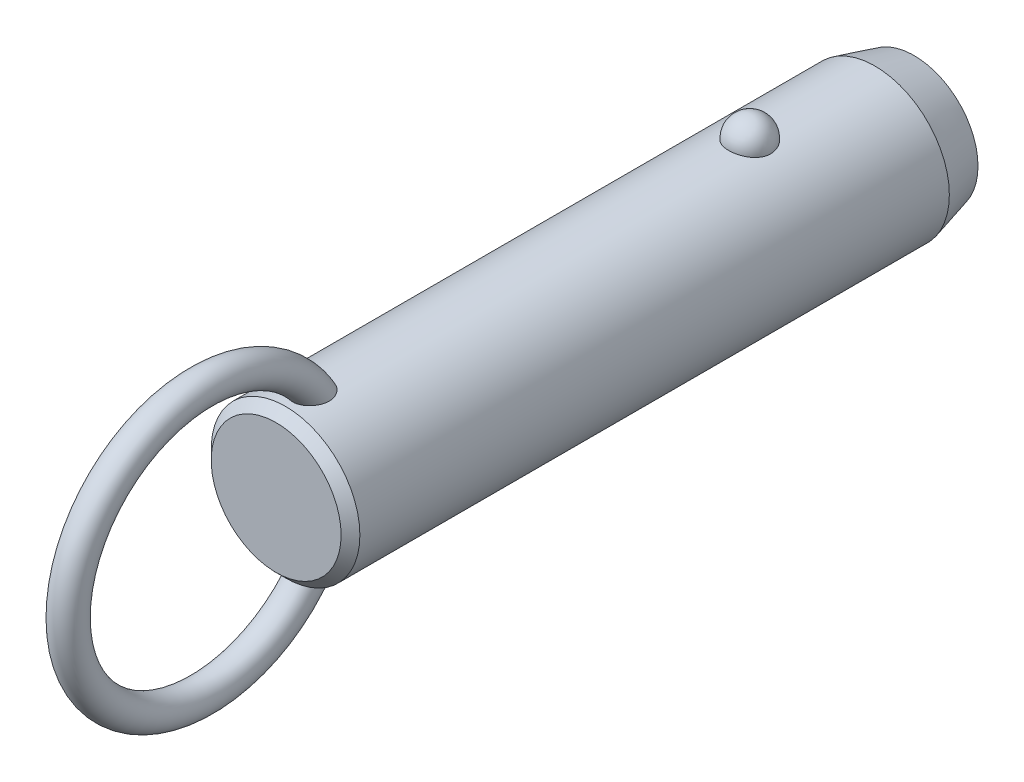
SolidWorks part; units mm, degrees
ref_plane "Front Plane" through (0, 0, 0) normal (0, 0, 1) x (1, 0, 0)
ref_plane "Top Plane" through (0, 0, 0) normal (0, 1, 0) x (1, 0, 0)
ref_plane "Right Plane" through (0, 0, 0) normal (1, 0, 0) x (0, 0, -1)
sketch "Sketch2" plane through (0, 0, 0) normal (0, 0, 1) x (1, 0, 0)
  circle A0 centre (0, 0) radius 9.5
  point P3 (0, 9.5)
  dimension "D1" = 19
extrude "Boss-Extrude1" add sketch "Sketch2" along normal blind 48.3
sketch "Sketch3" plane through (0, 0, 0) normal (0, 0, -1) x (-1, 0, 0)
  circle A0 centre (0, 0) radius 9.5
  dimension "D1" = 19
extrude "Boss-Extrude2" add sketch "Sketch3" along normal blind 23.7
chamfer "Chamfer1" distance 5 angle 15 1 edges at (-9.5, 0, -23.7)
sketch "Sketch12" plane through (0, 0, 0) normal (1, 0, 0) x (0, 0, -1)
  line L0 (-48.3, 9.5) -> (-48.3, -9.5) construction
  point P0 (-48.3, 0)
sketch "Sketch13" plane through (0, 0, 0) normal (1, 0, 0) x (0, 0, -1)
  circle A0 centre (-67.35, 0) radius 19.05
  point P2 (-48.3, 0)
  dimension "D1" = 38.1
sketch "Sketch14" plane through (0, 0, 0) normal (0, 1, 0) x (1, 0, 0)
  circle A0 centre (0, -50.3) radius 2
  point P2 (0, -48.3)
  dimension "D1" = 4
sweep "Sweep1" add profiles "Sketch14" path "Sketch13"
sketch "Sketch15" plane through (0, 0, 48.3) normal (0, 0, 1) x (1, 0, 0)
  circle A0 centre (0, 0) radius 9.5
  dimension "D1" = 19
extrude "Boss-Extrude3" add sketch "Sketch15" along normal blind 9.52
chamfer "Chamfer2" distance 1.2 angle 45 1 edges at (9.5, 0, 57.82)
sketch "Sketch18" plane through (0, 0, 0) normal (1, 0, 0) x (0, 0, -1)
  line L0 (18.7, 9.5) -> (-50.8378, 9.5) construction
  line L1 (2.7, 12.2) -> (2.7, 6.8)
  line L2 (-50.8378, -9.5) -> (18.7, -9.5) construction
  arc A0 (2.7, 12.2) -> (2.7, 6.8) centre (2.7, 9.5) ccw
  point P4 (0, 9.5)
  dimension "D1" = 21.7
revolve "Revolve1" add sketch "Sketch18" angle 360 about L1
